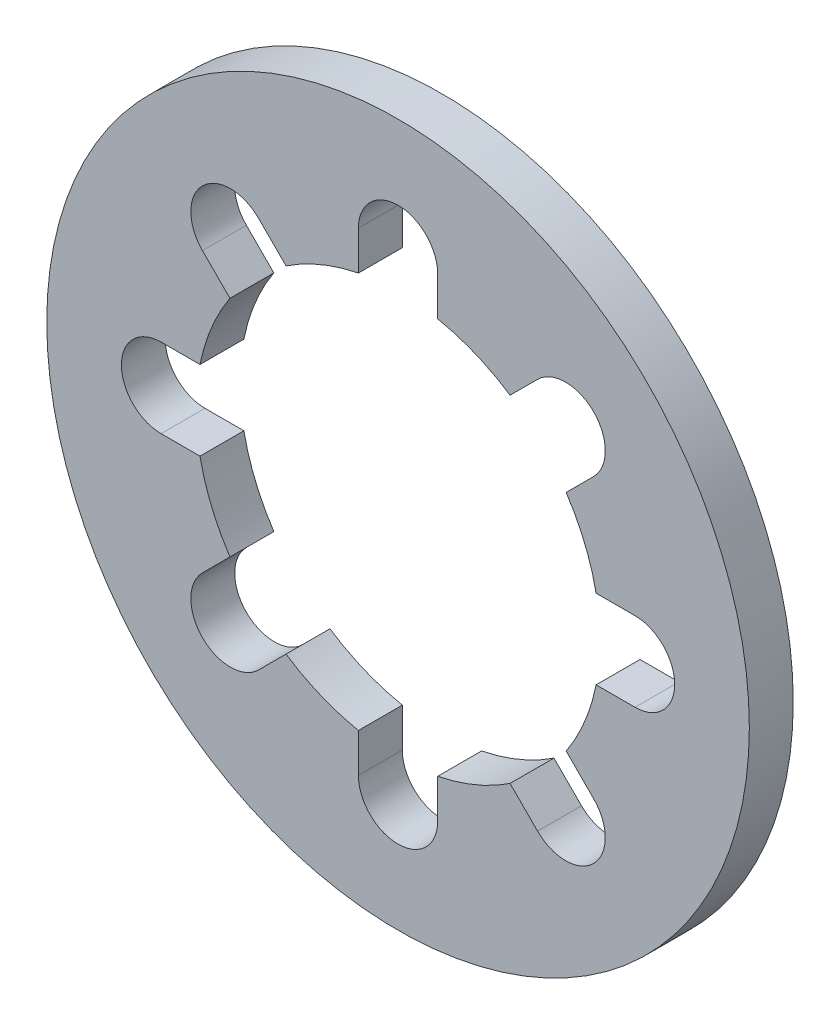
SolidWorks part; units mm, degrees
ref_plane "Front" through (0, 0, 0) normal (0, 0, 1) x (1, 0, 0)
ref_plane "Top" through (0, 0, 0) normal (0, 1, 0) x (1, 0, 0)
ref_plane "Right" through (0, 0, 0) normal (1, 0, 0) x (0, 0, -1)
sketch "Sketch1" plane through (0, 0, 0) normal (0, 0, 1) x (1, 0, 0)
  circle A0 centre (0, 0) radius 4
  circle A1 centre (0, 0) radius 2.3
  dimension "D0" = 8
  dimension "d" = 4.6
extrude "Base-Extrude" add sketch "Sketch1" against normal blind 0.5
sketch "Sketch2" plane through (-2.5554, 2.7609, 0) normal (0, 0, 1) x (1, 0, 0)
  line L0 (2.5554, -2.7609) -> (10.5554, -2.7609) construction
  line L1 (2.5554, -2.7609) -> (2.5554, -0.9214) construction
  line L2 (2.1038, -0.5057) -> (2.1038, -0.0625)
  line L3 (3.007, -0.0625) -> (3.007, -0.5057)
  line L4 (3.007, -0.5057) -> (2.1038, -0.5057)
  circle A0 centre (2.5554, -2.7609) radius 3.15 construction
  arc A1 (2.1038, -0.0625) -> (3.007, -0.0625) centre (2.5554, -0.0625) cw
  circle A5 centre (2.5554, -2.7609) radius 2.3 construction
  dimension "D2" = 6.3
  dimension "D1" = 8
  dimension "D3" = 0.9032
extrude "TypeBSlot" cut sketch "Sketch2" against normal through all
pattern_circular "TypeBPattern" count 8 over 360 about axis through (0, 0, 0) along (0, 0, 1) of "TypeBSlot"
equation "\"D2@Sketch2\" =  ( \"D0@Sketch1\" + \"d@Sketch1\" )  / 2"
equation "\"D3@Sketch2\" = \"d@Sketch1\" * 3.14159 / \"D1@Sketch2\" / 2"
